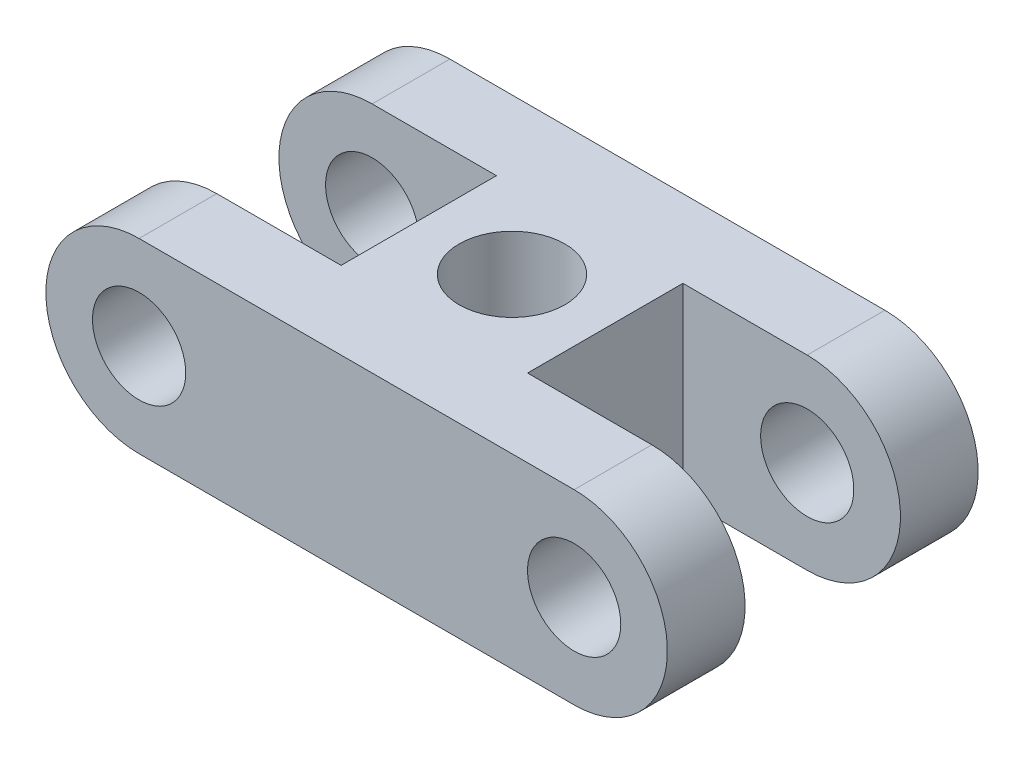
SolidWorks part; units mm, degrees
ref_plane "Front Plane" through (0, 0, 0) normal (0, 0, 1) x (1, 0, 0)
ref_plane "Top Plane" through (0, 0, 0) normal (0, 1, 0) x (1, 0, 0)
ref_plane "Right Plane" through (0, 0, 0) normal (1, 0, 0) x (0, 0, -1)
sketch "Sketch1" plane through (0, 0, 0) normal (0, 0, 1) x (1, 0, 0)
  line L0 (-14, 0) -> (14, 0) construction
  line L1 (-14, 6) -> (14, 6)
  line L2 (-14, -6) -> (14, -6)
  arc A0 (-14, 6) -> (-14, -6) centre (-14, 0) ccw
  arc A1 (14, -6) -> (14, 6) centre (14, 0) ccw
  circle A2 centre (-14, 0) radius 3
  circle A3 centre (14, 0) radius 3
  point P2 (0, 0)
  dimension "D2" = 6
  dimension "D3" = 6
  dimension "D1" = 28
extrude "Boss-Extrude1" add sketch "Sketch1" along normal mid plane 20
sketch "Sketch2" plane through (0, 6, 0) normal (0, 1, 0) x (1, 0, 0)
  line L0 (-20, 10) -> (-20, -10) construction
  line L1 (-34, 5) -> (-6, 5)
  line L2 (-34, 5) -> (-34, -5)
  line L3 (-34, -5) -> (-6, -5)
  line L4 (-6, 5) -> (-6, -5)
  line L5 (-34, 5) -> (-6, -5) construction
  line L6 (-34, -5) -> (-6, 5) construction
  line L7 (20, -10) -> (20, 10) construction
  line L8 (34, 5) -> (6, 5)
  line L9 (34, 5) -> (34, -5)
  line L10 (34, -5) -> (6, -5)
  line L11 (6, 5) -> (6, -5)
  line L12 (34, 5) -> (6, -5) construction
  line L13 (34, -5) -> (6, 5) construction
  circle A0 centre (0, 0) radius 3.4
  point P3 (-20, 0)
  point P10 (20, 0)
  dimension "D1" = 6.8
  dimension "D2" = 10
  dimension "D3" = 28
extrude "Cut-Extrude1" cut sketch "Sketch2" against normal through all both and the other way through all
